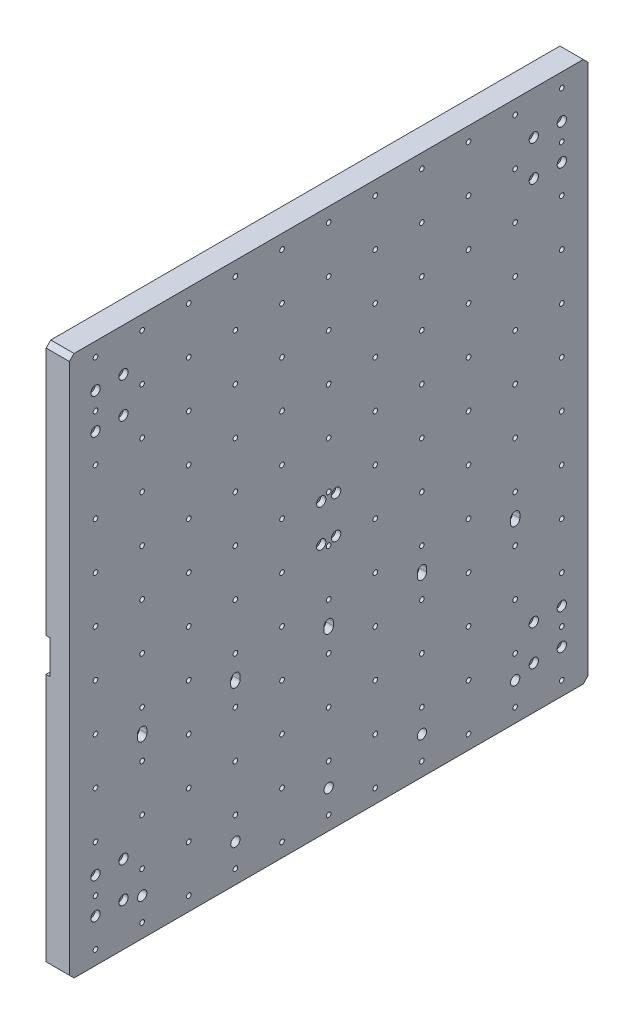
SolidWorks part; units mm, degrees
ref_plane "Plan1" through (0, 0, 0) normal (0, 0, 1) x (1, 0, 0)
ref_plane "Plan2" through (0, 0, 0) normal (0, 1, 0) x (1, 0, 0)
ref_plane "Plan3" through (0, 0, 0) normal (1, 0, 0) x (0, 0, -1)
sketch "Esquisse1" plane through (0, 0, 0) normal (1, 0, 0) x (0, 0, -1)
  line L0 (0, 252.8021) -> (0, -259.4921) construction
  line L1 (0, 13.75) -> (0, -13.75) construction
  line L2 (-434.6083, 0) -> (447.3364, 0) construction
  line L3 (-278, 290) -> (278, 290)
  line L4 (-278, 290) -> (-278, -290)
  line L5 (-278, -290) -> (278, -290)
  line L7 (13.75, 0) -> (-13.75, 0) construction
  line L11 (278, 290) -> (278, -290)
  dimension "D1" = 580
  dimension "D2" = 556
extrude "Boss.-Extru.1" add sketch "Esquisse1" against normal blind 25
hole_wizard "Chambrage pour vis à tête hexagonale M51" positions "Esquisse22" profile "Esquisse23" counterbore size "M5" standard "ISO"
sketch "Esquisse22" plane through (0, 0, 0) normal (1, 0, 0) x (0, 0, -1)
  line L0 (267.4012, 225) -> (-277.5094, 225) construction
  line L2 (235, 262.742) -> (235, 192.6102) construction
  line L4 (13.75, 0) -> (-13.75, 0) construction
  line L5 (0, 13.75) -> (0, -13.75) construction
  line L6 (278, -290) -> (278, 290) construction
  line L7 (278, 206) -> (250, 206)
  line L8 (250, 206) -> (220, 206)
  line L10 (-220, 206) -> (-250, 206)
  line L11 (-250, 206) -> (-278, 206)
  line L12 (-278, 290) -> (-278, -290) construction
  point P15 (250, 244)
  point P17 (250, 206)
  point P19 (220, 206)
  point P21 (220, 244)
  point P27 (-220, 206)
  point P29 (-250, 206)
  point P31 (-250, 244)
  point P33 (-220, 244)
  dimension "D1" = 225
  dimension "D2" = 235
  dimension "D3" = 38
  dimension "D4" = 30
  dimension "D5" = 28
  dimension "D6" = 470
sketch "Esquisse23" plane through (0, 244, 220) normal (0, 1, 0) x (0, 0, -1)
  line L0 (0, 0) -> (0, 25)
  line L1 (0, 25) -> (2.75, 25)
  line L3 (2.75, 25) -> (2.75, 5.4)
  line L4 (2.75, 5.4) -> (5, 5.4)
  line L5 (5, 5.4) -> (5, 0)
  line L7 (5, 0) -> (0, 0)
  line L11 (0, -6.35) -> (0, 107.95) construction
  dimension "Diamètre du perçage jusqu'au prochain" = 5.5
  dimension "Profondeur du perçage jusqu'au prochain" = 25
  dimension "Diamètre du chambrage" = 10
  dimension "Profondeur du chambrage" = 5.4
pattern_linear "Répétition linéaire1" count 2 spacing 450 along (0, -1, 0) of "Chambrage pour vis à tête hexagonale M51"
sketch "Esquisse24" plane through (-25, 0, 0) normal (1, 0, 0) x (0, 0, -1)
  line L0 (278, -290) -> (278, 290) construction
  line L1 (-321, 18) -> (278, 18)
  line L2 (-322, 17) -> (-322, -17)
  line L3 (-321, -18) -> (278, -18)
  line L4 (278, 18) -> (278, -18)
  line L5 (-313.3222, 0) -> (550.7958, 0) construction
  line L6 (13.75, 0) -> (-13.75, 0) construction
  arc A0 (-321, -18) -> (-322, -17) centre (-321, -17) cw
  arc A1 (-322, 17) -> (-321, 18) centre (-321, 17) cw
  dimension "D3" = 1
  dimension "D1" = 600
  dimension "D2" = 36
extrude "Enlèv. mat.-Extru.1" cut sketch "Esquisse24" along normal blind 4
sketch "Esquisse25" plane through (-25, 0, 0) normal (-1, 0, 0) x (0, 0, 1)
  line L0 (-278, 18) -> (-278, -18) construction
  line L1 (-278, 31) -> (-163, 31)
  line L2 (-278, 31) -> (-278, -31)
  line L3 (-278, -31) -> (-163, -31)
  line L4 (-153, 21) -> (-153, -21)
  line L6 (313.3222, 0) -> (-550.7958, 0) construction
  line L7 (313.3222, 0) -> (-550.7958, 0) construction
  arc A0 (-163, -31) -> (-153, -21) centre (-163, -21) ccw
  arc A1 (-153, 21) -> (-163, 31) centre (-163, 21) ccw
  dimension "D2" = 10
  dimension "D1" = 62
  dimension "D3" = 125
extrude "Enlèv. mat.-Extru.2" cut sketch "Esquisse25" against normal blind 9
hole_wizard "Trou taraudé M31" positions "Esquisse26" profile "Esquisse27" tap size "M3" standard "ISO"
sketch "Esquisse26" plane through (-25, 0, 0) normal (-1, 0, 0) x (0, 0, 1)
  line L0 (-278, -290) -> (-278, -31) construction
  line L1 (278, -290) -> (-278, -290) construction
  point P0 (-236, -277.5)
  point P2 (-206, -277.5)
  dimension "D1" = 30
  dimension "D2" = 42
  dimension "D3" = 12.5
sketch "Esquisse27" plane through (-25, -277.5, -236) normal (0, 1, 0) x (0, 0, 1)
  line L0 (0, 0) -> (0, 8.2511)
  line L1 (0, 8.2511) -> (1.25, 7.5)
  line L2 (1.25, 7.5) -> (1.25, 0)
  line L5 (1.25, 0) -> (0, 0)
  line L10 (0, 8.2511) -> (-1.25, 7.5) construction
  line L11 (0, -6.35) -> (0, 107.95) construction
  dimension "Diamètre du trou pour taraudage" = 2.5
  dimension "Profondeur du trou pour taraudage" = 7.5
  dimension "Angle de pointe" = 118
hole_wizard "Trou taraudé M61" positions "Esquisse28" profile "Esquisse29" tap size "M6" standard "ISO"
sketch "Esquisse28" plane through (0, 0, 0) normal (1, 0, 0) x (0, 0, -1)
  line L0 (278, -290) -> (278, 290) construction
  line L1 (-278, -290) -> (278, -290) construction
  point P0 (250, -275)
  dimension "D1" = 28
  dimension "D2" = 15
sketch "Esquisse29" plane through (0, -275, -250) normal (0, 1, 0) x (0, 0, -1)
  line L0 (0, 0) -> (0, 16.5022)
  line L1 (0, 16.5022) -> (2.5, 15)
  line L2 (2.5, 15) -> (2.5, 0)
  line L5 (2.5, 0) -> (0, 0)
  line L10 (0, 16.5022) -> (-2.5, 15) construction
  line L11 (0, -6.35) -> (0, 107.95) construction
  dimension "Diamètre du trou pour taraudage" = 5
  dimension "Profondeur du trou pour taraudage" = 15
  dimension "Angle de pointe" = 118
pattern_linear "Répétition linéaire2" count 11 spacing 50 along (0, 0, 1) count 12 spacing 50 along (0, 1, 0) of "Trou taraudé M61"
chamfer "Chanfrein1" distance 5 angle 45 4 edges at (-12.5, -290, -278) (-12.5, -290, 278) (-12.5, 290, 278) (-12.5, 290, -278)
hole_wizard "Diamètre du perçage Ø10.0 (10)1" positions "Esquisse30" profile "Esquisse31" hole size "Ø10.0" standard "ISO"
sketch "Esquisse30" plane through (0, 0, 0) normal (1, 0, 0) x (0, 0, -1)
  line L0 (-273, -290) -> (273, -290) construction
  line L1 (0, 13.75) -> (0, -13.75) construction
  point P0 (-200, -250)
  dimension "D1" = 40
  dimension "D2" = 200
sketch "Esquisse31" plane through (0, -250, 200) normal (0, 1, 0) x (0, 0, -1)
  line L0 (0, 0) -> (0, 18.0043)
  line L1 (0, 18.0043) -> (5, 15)
  line L2 (5, 15) -> (5, 0)
  line L5 (5, 0) -> (0, 0)
  line L10 (0, 18.0043) -> (-5, 15) construction
  line L11 (0, -6.35) -> (0, 107.95) construction
  dimension "Diamètre du perçage" = 10
  dimension "Profondeur du perçage" = 15
  dimension "Angle de pointe" = 118
sketch "Esquisse32" plane through (0, 0, 0) normal (1, 0, 0) x (0, 0, -1)
  line L0 (-200, -98) -> (-200, -102) construction
  line L1 (-195, -98) -> (-195, -102)
  line L2 (-205, -98) -> (-205, -102)
  arc A0 (-195, -98) -> (-205, -98) centre (-200, -98) ccw
  arc A1 (-205, -102) -> (-195, -102) centre (-200, -102) ccw
  point P2 (-200, -100)
  dimension "D1" = 150
  dimension "D2" = 10
  dimension "D3" = 4
extrude "Enlèv. mat.-Extru.3" cut sketch "Esquisse32" against normal blind 8
pattern_linear "Répétition linéaire4" count 5 spacing 100 along (0, 0, -1) of "Enlèv. mat.-Extru.3", "Diamètre du perçage Ø10.0 (10)1"
hole_wizard "Chambrage pour vis à tête hexagonale M52" positions "Esquisse33" profile "Esquisse34" counterbore size "M5" standard "ISO"
sketch "Esquisse33" plane through (0, 0, 0) normal (1, 0, 0) x (0, 0, -1)
  line L0 (337.6503, 0) -> (-76.8898, 0) construction
  line L2 (13.75, 0) -> (-13.75, 0) construction
  line L3 (278, -285) -> (278, 285) construction
  point P6 (-8, 20)
  point P8 (8, 20)
  point P10 (8, -20)
  point P11 (-8, -20)
  dimension "D1" = 16
  dimension "D2" = 40
  dimension "D3" = 286
sketch "Esquisse34" plane through (0, -20, 8) normal (0, 1, 0) x (0, 0, -1)
  line L0 (0, 0) -> (0, 25)
  line L1 (0, 25) -> (2.75, 25)
  line L3 (2.75, 25) -> (2.75, 5.4)
  line L4 (2.75, 5.4) -> (5, 5.4)
  line L5 (5, 5.4) -> (5, 0)
  line L7 (5, 0) -> (0, 0)
  line L11 (0, -6.35) -> (0, 107.95) construction
  dimension "Diamètre du perçage jusqu'au prochain" = 5.5
  dimension "Profondeur du perçage jusqu'au prochain" = 25
  dimension "Diamètre du chambrage" = 10
  dimension "Profondeur du chambrage" = 5.4
sketch "Esquisse35" plane through (-25, 0, 0) normal (-1, 0, 0) x (0, 0, 1)
  line L0 (-307.7393, 0) -> (339.9239, 0) construction
  line L1 (-82, 31) -> (11, 31)
  line L2 (-88, 25) -> (-88, -25)
  line L3 (-82, -31) -> (11, -31)
  line L4 (17, 25) -> (17, -25)
  line L5 (13.75, 0) -> (-13.75, 0) construction
  circle A0 centre (8, 20) radius 2.75 construction
  arc A1 (-88, -25) -> (-82, -31) centre (-82, -25) ccw
  arc A2 (11, -31) -> (17, -25) centre (11, -25) ccw
  arc A3 (17, 25) -> (11, 31) centre (11, 25) ccw
  arc A4 (-82, 31) -> (-88, 25) centre (-82, 25) ccw
  dimension "D2" = 9
  dimension "D4" = 6
  dimension "D1" = 62
  dimension "D3" = 105
extrude "Enlèv. mat.-Extru.4" cut sketch "Esquisse35" against normal up to surface (4 mm away)
